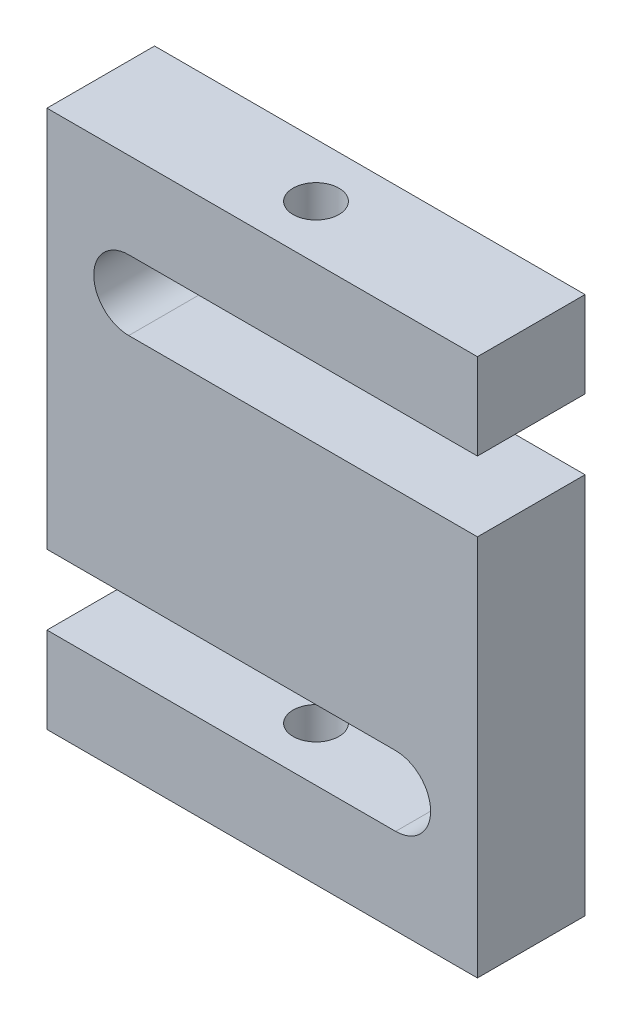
SolidWorks part; units mm, degrees
ref_plane "Front Plane" through (0, 0, 0) normal (0, 0, 1) x (1, 0, 0)
ref_plane "Top Plane" through (0, 0, 0) normal (0, 1, 0) x (1, 0, 0)
ref_plane "Right Plane" through (0, 0, 0) normal (1, 0, 0) x (0, 0, -1)
sketch "Sketch1" plane through (0, 0, 0) normal (0, 0, 1) x (1, 0, 0)
  line L0 (-25.4, -31.75) -> (25.4, -31.75)
  line L1 (25.4, -31.75) -> (25.4, 13.335)
  line L2 (25.4, 31.75) -> (-25.4, 31.75)
  line L3 (-25.4, 31.75) -> (-25.4, -13.335)
  line L4 (-25.4, -13.335) -> (15.748, -13.335)
  line L5 (-25.4, -21.59) -> (15.748, -21.59)
  line L6 (-69.5262, 0) -> (58.1333, 0) construction
  line L7 (15.748, -13.335) -> (15.748, -21.59) construction
  line L8 (-25.4, -21.59) -> (-25.4, -31.75)
  line L9 (-15.748, 21.59) -> (25.4, 21.59)
  line L10 (-15.748, 13.335) -> (25.4, 13.335)
  line L11 (25.4, 21.59) -> (25.4, 31.75)
  line L12 (-15.748, 21.59) -> (-15.748, 13.335) construction
  arc A0 (15.748, -21.59) -> (15.748, -13.335) centre (15.748, -17.4625) ccw
  arc A1 (-15.748, 21.59) -> (-15.748, 13.335) centre (-15.748, 17.4625) ccw
  dimension "D6" = 9.652
  dimension "D1" = 50.8
  dimension "D2" = 63.5
  dimension "D3" = 31.75
  dimension "D4" = 8.255
  dimension "D5" = 10.16
  dimension "D7" = 25.4
extrude "Extrude1" add sketch "Sketch1" along normal mid plane 12.7
hole_wizard "1/4-28 Tapped Hole1" positions "3DSketch2" profile "Sketch9" tap size "1/4-28" standard "Ansi Inch"
sketch3d "3DSketch2"
  point P0 (0, 31.75, 0)
sketch "Sketch9" plane through (0, 31.75, 0) normal (1, 0, 0) x (0, 0, 1)
  line L0 (0, 0) -> (0, 45.085)
  line L1 (0, 45.085) -> (2.7051, 45.085)
  line L2 (2.7051, 45.085) -> (2.7051, 0)
  line L5 (2.7051, 0) -> (0, 0)
  line L11 (0, -6.35) -> (0, 107.95) construction
  dimension "Thru Tap Drill Dia." = 5.4102
  dimension "Thru Tap Drill Depth" = 45.085
mirror "Mirror1" about plane through (0, 0, 0) normal (0, 1, 0) of "1/4-28 Tapped Hole1"
